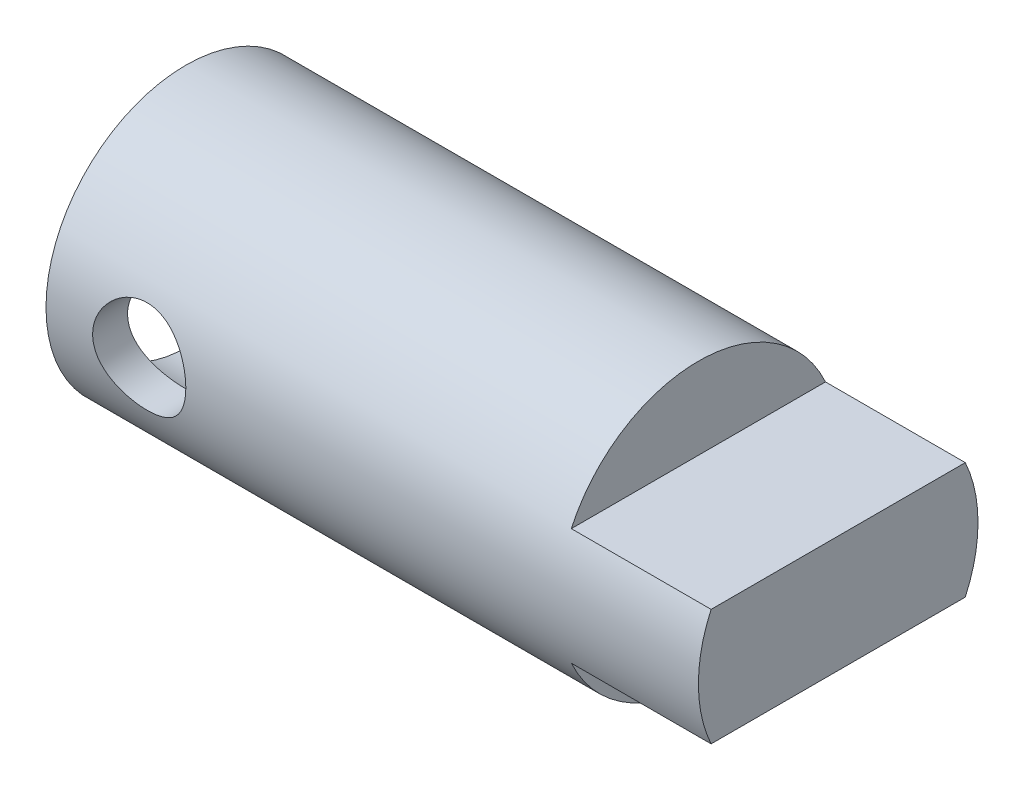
SolidWorks part; units mm, degrees
ref_plane "Face" through (0, 0, 0) normal (0, 0, 1) x (1, 0, 0)
ref_plane "Dessus" through (0, 0, 0) normal (0, 1, 0) x (1, 0, 0)
ref_plane "Droite" through (0, 0, 0) normal (1, 0, 0) x (0, 0, -1)
sketch "Esquisse1" plane through (0, 0, 0) normal (0, 0, 1) x (1, 0, 0)
  line L0 (-58.2555, 0) -> (72.2066, 0) construction
  line L2 (0, 4.5) -> (-14, 4.5)
  line L3 (-14, 4.5) -> (-14, 6)
  line L4 (-14, 6) -> (14, 6)
  line L5 (14, 6) -> (14, 0)
  line L6 (14, 0) -> (1.6116, 0)
  line L7 (0, 4.5) -> (1.6116, 0)
  dimension "D1" = 9
  dimension "D2" = 12
revolve "Base-Révolution" add sketch "Esquisse1" angle 360 about L0
sketch "Esquisse2" plane through (0, 0, 0) normal (0, 0, 1) x (1, 0, 0)
  line L0 (0, 0) -> (14.7158, 0) construction
  line L1 (-58.2555, 0) -> (72.2066, 0) construction
  line L2 (14, -6) -> (14, 6) construction
  line L3 (8, 8.294) -> (15.1777, 8.294)
  line L4 (8, 8.294) -> (8, 2.5)
  line L5 (8, 2.5) -> (15.1777, 2.5)
  line L6 (15.1777, 8.294) -> (15.1777, 2.5)
  line L7 (15.1777, -8.294) -> (15.1777, -2.5)
  line L8 (8, -8.294) -> (15.1777, -8.294)
  line L9 (8, -8.294) -> (8, -2.5)
  line L10 (8, -2.5) -> (15.1777, -2.5)
  dimension "D3" = 5
  dimension "D4" = 6
extrude "Enlèv. mat.-Extru.1" cut sketch "Esquisse2" against normal mid plane 30
sketch "Esquisse3" plane through (0, 0, 0) normal (0, 0, 1) x (1, 0, 0)
  line L0 (0, 0) -> (-25.098, 0) construction
  line L1 (-14, 6) -> (-14, -6) construction
  circle A0 centre (-10, 0) radius 2
  dimension "D1" = 4
  dimension "D2" = 4
extrude "Enlèv. mat.-Extru.2" cut sketch "Esquisse3" against normal mid plane 30
